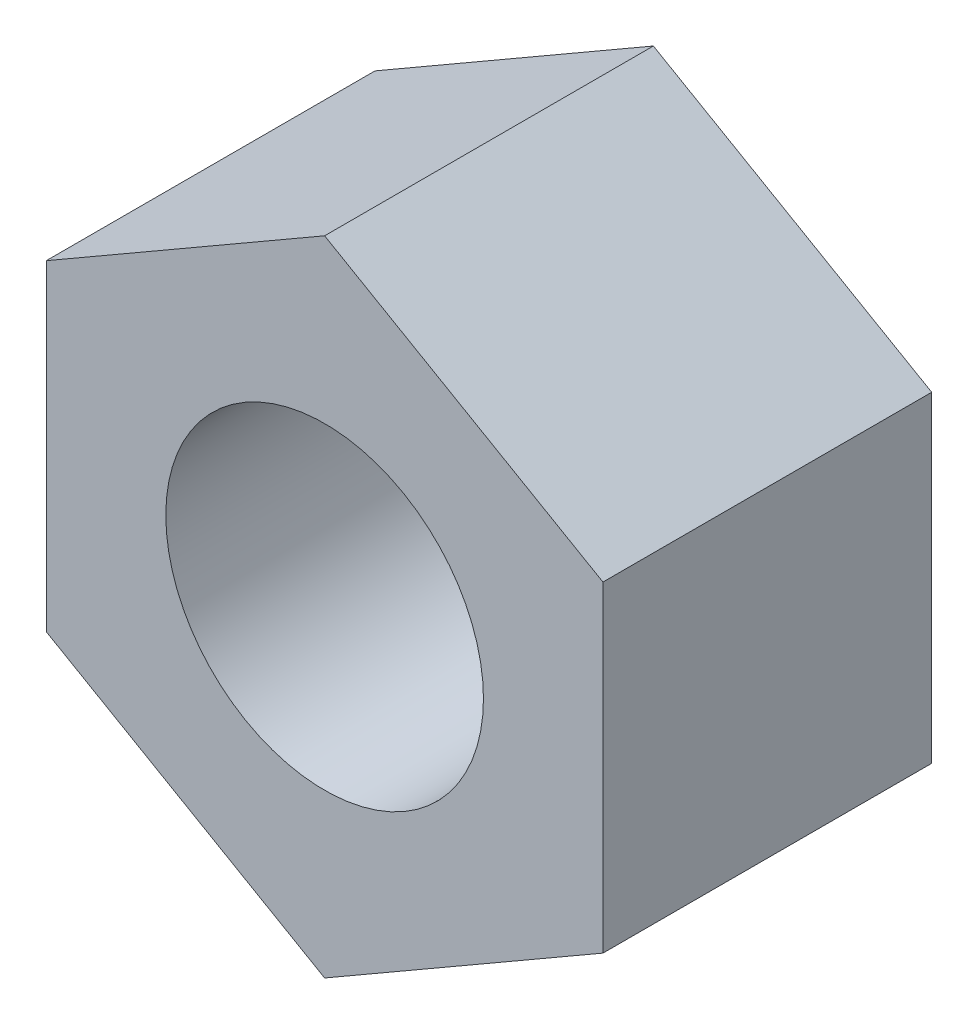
SolidWorks part; units mm, degrees
ref_plane "Plane1" through (0, 0, 0) normal (0, 0, 1) x (1, 0, 0)
ref_plane "Plane2" through (0, 0, 0) normal (0, 1, 0) x (1, 0, 0)
ref_plane "Plane3" through (0, 0, 0) normal (1, 0, 0) x (0, 0, -1)
sketch "Sketch1" plane through (0, 0, 0) normal (0, 0, 1) x (1, 0, 0)
  line L1 (0, 8.0949) -> (-7.0104, 4.0475)
  line L2 (-7.0104, 4.0475) -> (-7.0104, -4.0475)
  line L3 (-7.0104, -4.0475) -> (0, -8.0949)
  line L4 (0, -8.0949) -> (7.0104, -4.0475)
  line L5 (7.0104, -4.0475) -> (7.0104, 4.0475)
  line L6 (7.0104, 4.0475) -> (0, 8.0949)
  circle A0 centre (0, 0) radius 7.0104 construction
  circle A1 centre (0, 0) radius 4.0005
  dimension "D1" = 8.001
  dimension "D2" = 14.0208
extrude "Base-Extrude" add sketch "Sketch1" along normal blind 8.2804
